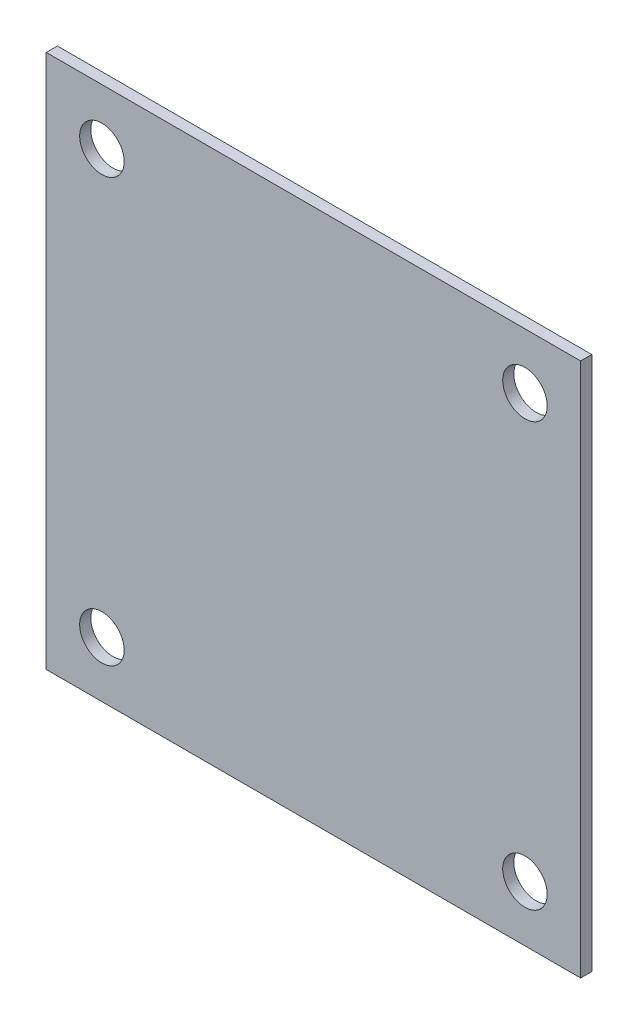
SolidWorks part; units mm, degrees
ref_plane "Front Plane" through (0, 0, 0) normal (0, 0, 1) x (1, 0, 0)
ref_plane "Top Plane" through (0, 0, 0) normal (0, 1, 0) x (1, 0, 0)
ref_plane "Right Plane" through (0, 0, 0) normal (1, 0, 0) x (0, 0, -1)
sketch "Sketch1" plane through (0, 0, 0) normal (0, 0, 1) x (1, 0, 0)
  line L0 (-76.2, 0) -> (76.2, 0) construction
  line L1 (-76.2, 76.2) -> (76.2, 76.2)
  line L2 (-76.2, 76.2) -> (-76.2, -76.2)
  line L3 (-76.2, -76.2) -> (76.2, -76.2)
  line L4 (76.2, 76.2) -> (76.2, -76.2)
  line L5 (0, -76.2) -> (0, 76.2) construction
  circle A0 centre (-60.325, 60.325) radius 6.35
  circle A4 centre (60.325, 60.325) radius 6.35
  circle A5 centre (60.325, -60.325) radius 6.35
  circle A6 centre (-60.325, -60.325) radius 6.35
  point P4 (0, 76.2)
  point P6 (76.2, 0)
  point P13 (0, 76.2)
  point P14 (76.2, 0)
  point P15 (-76.2, 0)
extrude "Boss-Extrude1" add sketch "Sketch1" along normal blind 3.175
equation "\"D5@Sketch1\"=\"D4@Sketch1\""
